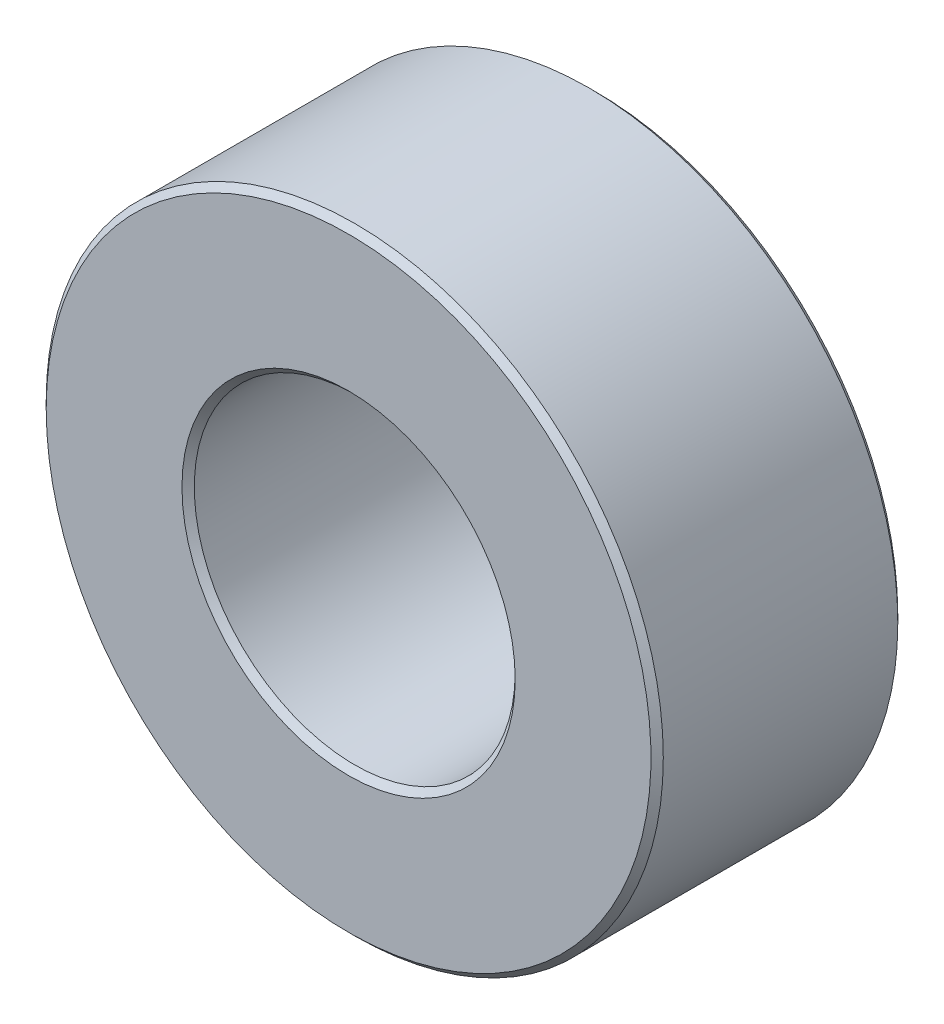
SolidWorks part; units mm, degrees
ref_plane "Front Plane" through (0, 0, 0) normal (0, 0, 1) x (1, 0, 0)
ref_plane "Top Plane" through (0, 0, 0) normal (0, 1, 0) x (1, 0, 0)
ref_plane "Right Plane" through (0, 0, 0) normal (1, 0, 0) x (0, 0, -1)
sketch "Sketch1" plane through (0, 0, 0) normal (0, 0, 1) x (1, 0, 0)
  circle A0 centre (0, 0) radius 5
  circle A1 centre (0, 0) radius 2.6
  dimension "D1" = 10
  dimension "D2" = 5.2
extrude "Boss-Extrude2" add sketch "Sketch1" along normal mid plane 4
chamfer "Chamfer3" distance 0.1 angle 45 4 edges at (5, 0, 2) (5, 0, -2) (2.6, 0, -2) (2.6, 0, 2)
